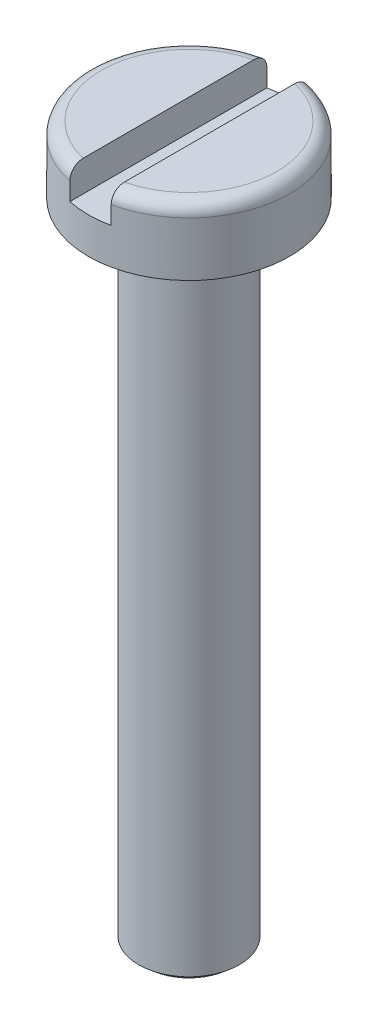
SolidWorks part; units mm, degrees
ref_plane "Face" through (0, 0, 0) normal (0, 0, 1) x (1, 0, 0)
ref_plane "Dessus" through (0, 0, 0) normal (0, 1, 0) x (1, 0, 0)
ref_plane "Droite" through (0, 0, 0) normal (1, 0, 0) x (0, 0, -1)
sketch "Esquisse1" plane through (0, 0, 0) normal (0, 1, 0) x (1, 0, 0)
  circle A0 centre (0, 0) radius 3.9
extrude "Boss.-Extru.1" add sketch "Esquisse1" along normal blind 2.6
ref_plane "Plan1" through (0, 0, 0) normal (0, 0, 1) x (1, 0, 0)
sketch "Esquisse2" plane through (0, 0, 0) normal (0, 0, 1) x (1, 0, 0)
  line L0 (0, -1.4267) -> (0, 4.5138) construction
  line L1 (-0.8, 5.1834) -> (-0.8, 1.5365) construction
  line L2 (0.8, 5.1834) -> (0.8, 1.5365) construction
  line L3 (7.1727, 2.6) -> (-1.2323, 2.6) construction
  line L5 (7.1727, 1.4) -> (-1.2323, 1.4) construction
  line L7 (-0.8, 1.4) -> (0.8, 1.4)
  line L8 (-0.8, 1.4) -> (-0.8, 2.6)
  line L9 (-0.8, 2.6) -> (0.8, 2.6)
  line L10 (0.8, 1.4) -> (0.8, 2.6)
  dimension "D1" = 0.8
  dimension "D2" = 1.6
  dimension "D3" = 1.2
extrude "Enlèv. mat.-Extru.1" cut sketch "Esquisse2" against normal mid plane 15
fillet "Congé1" radius 0.5 2 edges at (3.9, 2.6, 0) (-3.9, 2.6, 0)
sketch "Esquisse3" plane through (0, 0, 0) normal (0, -1, 0) x (1, 0, 0)
  circle A0 centre (0, 0) radius 1.95
extrude "Boss.-Extru.2" add sketch "Esquisse3" along normal blind 25
chamfer "Chanfrein1" distance 0.25 angle 50 1 edges at (0, -25, -1.95)
